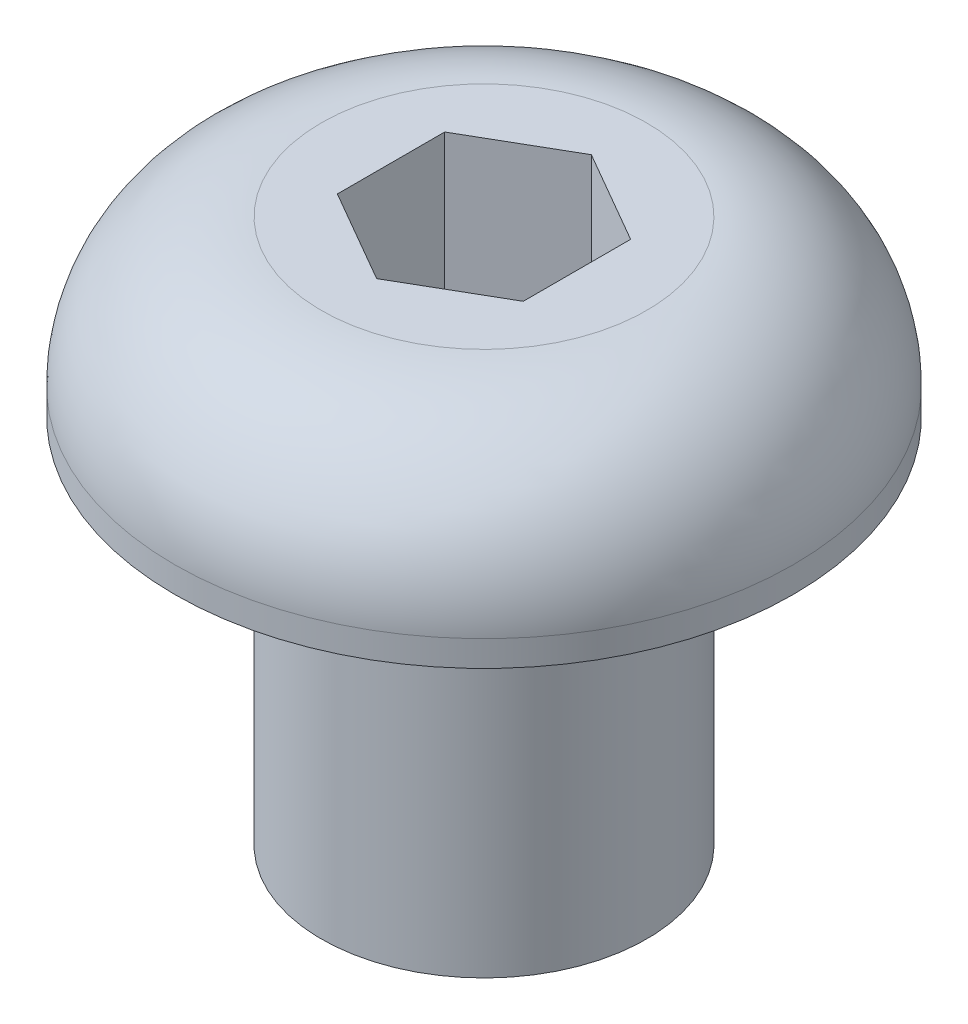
SolidWorks part; units mm, degrees
ref_plane "Front Plane" through (0, 0, 0) normal (0, 0, 1) x (1, 0, 0)
ref_plane "Top Plane" through (0, 0, 0) normal (0, 1, 0) x (1, 0, 0)
ref_plane "Right Plane" through (0, 0, 0) normal (1, 0, 0) x (0, 0, -1)
sketch "Sketch1" plane through (0, 0, 0) normal (0, 0, 1) x (1, 0, 0)
  line L0 (0, 0) -> (0, -6.9723) construction
  line L1 (0, -6.9723) -> (2.0828, -6.9723)
  line L2 (2.0828, -6.9723) -> (2.0828, -2.2098)
  line L3 (2.0828, -2.2098) -> (3.9624, -2.2098)
  line L4 (3.9624, -2.2098) -> (3.9624, -1.8796)
  line L5 (2.0828, 0) -> (0, 0)
  line L6 (0, 0) -> (0, -6.9723)
  arc A0 (3.9624, -1.8796) -> (2.0828, 0) centre (2.0828, -1.8796) ccw
  dimension "D1" = 2.2098
  dimension "D2" = 2.0828
  dimension "D3" = 4.7625
  dimension "D4" = 3.9624
revolve "Revolve1" add sketch "Sketch1" angle 360 about L0
sketch "Sketch2" plane through (0, 0, 0) normal (0, 1, 0) x (1, 0, 0)
  line L1 (0, 1.3748) -> (-1.1906, 0.6874)
  line L2 (-1.1906, 0.6874) -> (-1.1906, -0.6874)
  line L3 (-1.1906, -0.6874) -> (0, -1.3748)
  line L4 (0, -1.3748) -> (1.1906, -0.6874)
  line L5 (1.1906, -0.6874) -> (1.1906, 0.6874)
  line L6 (1.1906, 0.6874) -> (0, 1.3748)
  circle A0 centre (0, 0) radius 1.1906 construction
  dimension "D1" = 2.3813
extrude "Cut-Extrude1" cut sketch "Sketch2" against normal blind 2.54
